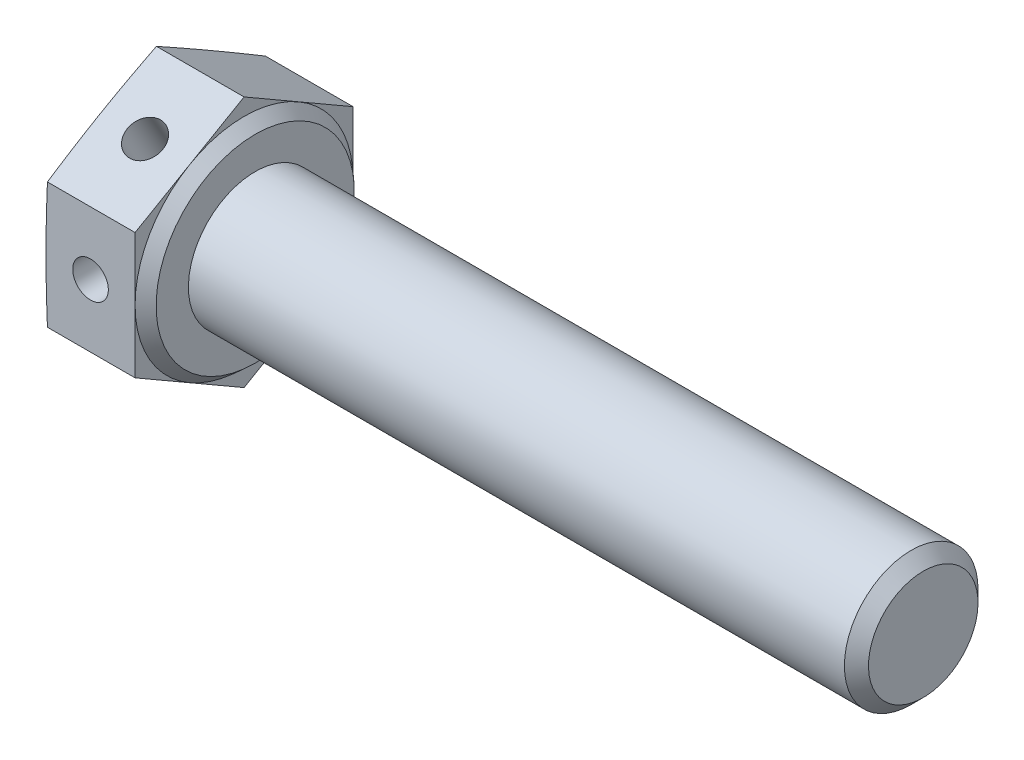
SolidWorks part; units mm, degrees
ref_plane "Front" through (0, 0, 0) normal (0, 0, 1) x (1, 0, 0)
ref_plane "Top" through (0, 0, 0) normal (0, 1, 0) x (1, 0, 0)
ref_plane "Right" through (0, 0, 0) normal (1, 0, 0) x (0, 0, -1)
sketch "Sketch-BaseHead" plane through (0, 0, 0) normal (1, 0, 0) x (0, 0, -1)
  line L1 (0, -5.6523) -> (4.895, -2.8261)
  line L2 (4.895, -2.8261) -> (4.895, 2.8261)
  line L3 (4.895, 2.8261) -> (0, 5.6523)
  line L4 (0, 5.6523) -> (-4.895, 2.8261)
  line L5 (-4.895, 2.8261) -> (-4.895, -2.8261)
  line L6 (-4.895, -2.8261) -> (0, -5.6523)
  circle A0 centre (0, 0) radius 4.895 construction
  dimension "s" = 9.79
extrude "BaseHead" add sketch "Sketch-BaseHead" along normal blind 4
sketch "Sketch4" plane through (-0.2646, -5.9169, 0) normal (0, 0, 1) x (0, 1, 0)
  line L0 (5.9169, 3.7369) -> (5.9169, -10.4477) construction
  line L2 (11.5692, -0.2646) -> (10.8119, -0.2646)
  line L4 (10.8119, -0.2646) -> (11.5692, -0.3295)
  line L6 (11.5692, -0.3295) -> (11.5692, -0.2646)
  dimension "D1" = 4.895
  dimension "D2" = 9.79
revolve "HeadChamfer" cut sketch "Sketch4" angle 360 about L0
sketch "Sketch2" plane through (0, 0, 0) normal (0, 1, 0) x (1, 0, 0)
  line L0 (4, 0) -> (4.5, 0)
  line L1 (4.5, 0) -> (4.5, 4.45)
  line L2 (4.5, 4.45) -> (4, 4.895)
  line L3 (4, 4.895) -> (4, 0)
  line L4 (4, 4.895) -> (4, 0) construction
  dimension "D1" = 4.895
  dimension "D2" = 4.45
  dimension "c" = 0.5
revolve "Revolve1" add sketch "Sketch2" angle 360 about axis through (-4.0016, 0, 0) along (1, 0, 0)
ref_plane "Plane2" through (19.5, 0, 0) normal (1, 0, 0) x (0, 0, -1)
sketch "Sketch3" plane through (4.5, 0, 0) normal (1, 0, 0) x (0, 0, -1)
  circle A0 centre (0, 0) radius 3
  dimension "d" = 6
extrude "BaseBody" add sketch "Sketch3" along normal blind 30
chamfer "Chamfer1" distance 0.5415 angle 45 1 edges at (34.5, 3, 0)
fillet "HeadFillet" [suppressed] radius 0.25
sketch "Sketch5" plane through (0, 0, 0) normal (0, 0, 1) x (1, 0, 0)
  line L1 (4, -4.2392) -> (4, -5.6523) construction
  line L2 (-4.0016, 0) -> (10.1831, 0) construction
  circle A0 centre (2, 0) radius 0.8
  dimension "d1" = 1.6
  dimension "h" = 2
extrude "Hole" cut sketch "Sketch5" against normal through all and the other way through all
pattern_circular "CirPattern1" count 2 over 60 about axis through (34.5, 0, 0) along (-1, 0, 0) of "Hole"
sketch "Sketch6" plane through (0, 0, 0) normal (0, 0, 1) x (1, 0, 0)
  line L0 (33.416, 3.2) -> (33.9575, 3.2)
  line L1 (33.9575, 3.2) -> (33.9575, 3)
  line L2 (33.9575, 3) -> (33.6867, 2.531)
  line L3 (33.416, 3) -> (33.6867, 2.531)
  line L4 (33.416, 3.2) -> (33.416, 3)
  line L5 (34.549, 0) -> (0, 0) construction
  line L6 (33.416, 3) -> (33.9575, 3) construction
  line L7 (33.6867, 3) -> (33.6867, 2.531) construction
  line L8 (33.9585, 3) -> (4.5, 3) construction
  point P5 (33.6867, 3.2)
  dimension "D1" = 0.2
  dimension "D2" = 0.5415
  dimension "D3" = 0.001
revolve "Cut-Revolve10" [suppressed] cut sketch "Sketch6" angle 360 about L5
pattern_linear "LPattern10" [suppressed] count 23 spacing 0.6498
equation "\"D1@Sketch4\" = \"s@Sketch-BaseHead\"/ 2 "
equation "\"D2@Sketch4\" = \"s@Sketch-BaseHead\""
equation "\"D1@Chamfer1\" =  ( \"d@Sketch3\" - \"D2@ThreadCosmetic1\" ) / 2 "
equation "\"b@ThreadCosmetic1\" = \"l@BaseBody\" - \"lg@Plane2\""
equation "\"D1@Sketch2\"=\"s@Sketch-BaseHead\"/2"
equation "\"D2@Sketch6\" = (  \"d@Sketch3\" - \"D2@ThreadCosmetic1\" )  / 2"
equation "\"D3@LPattern10\" = \"D2@Sketch6\" * 1.2"
equation "\"D1@LPattern10\" = \"b@ThreadCosmetic1\" / \"D3@LPattern10\""
